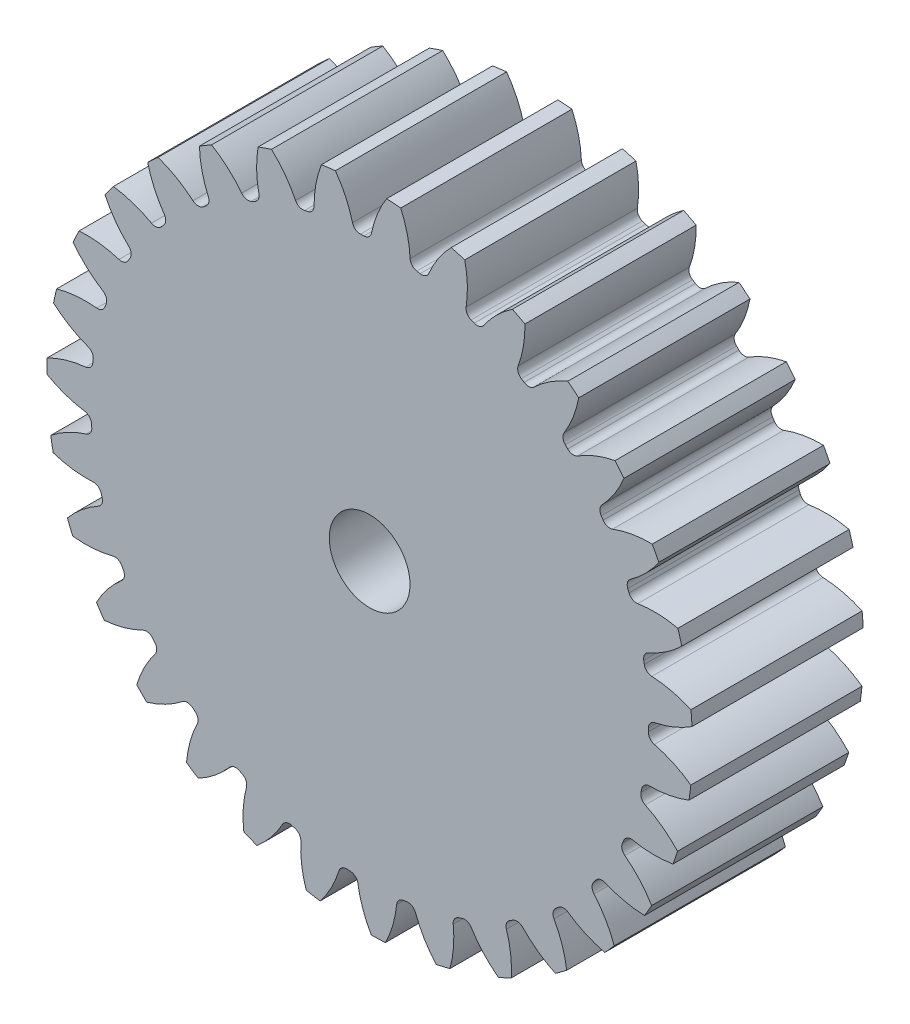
SolidWorks part; units mm, degrees
ref_plane "Front" through (0, 0, 0) normal (0, 0, 1) x (1, 0, 0)
ref_plane "Top" through (0, 0, 0) normal (0, 1, 0) x (1, 0, 0)
ref_plane "Right" through (0, 0, 0) normal (1, 0, 0) x (0, 0, -1)
sketch "Sketch3" plane through (0, 0, 0) normal (0, 0, 1) x (1, 0, 0)
  circle A0 centre (0, 0) radius 167.64
  dimension "od" = 335.28
extrude "gearBody" add sketch "Sketch3" along normal blind 88.9
sketch "Sketch2" plane through (0, 0, 0) normal (0, 0, 1) x (1, 0, 0)
  line L0 (0, 0) -> (136.7183, 56.6306) construction
  line L1 (166.9965, -17.4764) -> (0, 0) construction
  line L2 (0, 0) -> (36.3143, 0) construction
  line L3 (157.4241, 4.1953) -> (157.0449, -11.6984) construction
  line L5 (157.2345, -3.7516) -> (0, 0) construction
  line L7 (0, 0) -> (147.9828, 0) construction
  arc A0 (147.9763, 1.3907) -> (147.7416, -8.4464) centre (0, 0) ccw construction
  arc A1 (167.3806, 9.3229) -> (166.7455, -17.2951) centre (0, 0) ccw construction
  arc A2 (157.4241, 4.1953) -> (157.0449, -11.6984) centre (0, 0) ccw construction
  arc A3 (144.715, -4.3373) -> (144.7572, -2.5694) centre (0, 0) ccw
  arc A4 (166.9965, -17.4764) -> (147.8242, -8.4674) centre (133.8619, -63.0865) ccw
  arc A5 (166.9965, -17.4764) -> (167.64, 9.4921) centre (0, 0) ccw
  arc A6 (167.64, 9.4921) -> (148.0598, 1.4078) centre (136.7183, 56.6306) cw
  arc A7 (144.7572, -2.5694) -> (148.0598, 1.4078) centre (148.8917, -2.6428) cw
  arc A8 (147.8242, -8.4674) -> (144.715, -4.3373) centre (148.8483, -4.4612) cw
  point P6 (167.64, 9.4921)
  point P22 (166.9965, -17.4764)
  dimension "baseDia" = 295.9656
  dimension "od" = 335.28
  dimension "pd" = 314.96
  dimension "rd" = 289.56
  dimension "rFillet" = 4.1351
  dimension "pointX" = 167.64
  dimension "pointY" = 9.4921
  dimension "CTT" = 15.8937
  dimension "flankCenterAngle" = 22.5
extrude "toothCut" cut sketch "Sketch2" along normal through all
pattern_circular "CirPattern1" count 31 over 360 about axis through (0, 0, 0) along (0, 0, 1) of "toothCut"
sketch "hub1Dia" plane through (0, 0, 0) normal (0, 0, -1) x (-1, 0, 0)
  circle A0 centre (0, 0) radius 12.7
  dimension "hub1Dia" = 25.4
sketch "hub2Dia" plane through (0, 0, 88.9) normal (0, 0, 1) x (1, 0, 0)
  circle A0 centre (0, 0) radius 12.7
  dimension "hub2dia" = 25.4
sketch "boreDia" plane through (0, 0, 0) normal (0, 0, 1) x (1, 0, 0)
  circle A0 centre (0, 0) radius 20.955
  dimension "boreDia" = 41.91
extrude "bore" cut sketch "boreDia" against normal mid plane 25400
